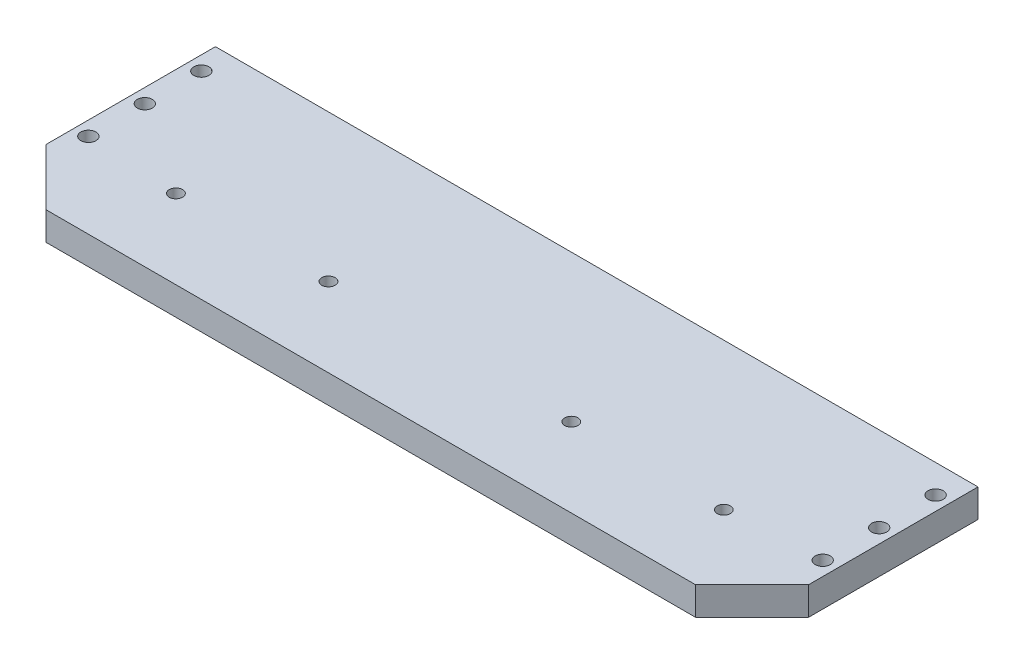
SolidWorks part; units mm, degrees
ref_plane "Front Plane" through (0, 0, 0) normal (0, 0, 1) x (1, 0, 0)
ref_plane "Top Plane" through (0, 0, 0) normal (0, 1, 0) x (1, 0, 0)
ref_plane "Right Plane" through (0, 0, 0) normal (1, 0, 0) x (0, 0, -1)
sketch "Sketch1" plane through (0, 0, 0) normal (0, 0, 1) x (1, 0, 0)
  line L0 (-223.8, 279.4) -> (-12.7, 279.4) construction
  line L1 (-32.5251, 279.4) -> (-203.9751, 279.4)
  line L2 (-32.5251, 279.4) -> (-32.5251, 273.05)
  line L3 (-32.5251, 273.05) -> (-203.9751, 273.05)
  line L4 (-203.9751, 279.4) -> (-203.9751, 273.05)
  line L5 (-12.474, 431.1636) -> (-12.474, 127.8876) construction
  dimension "D1" = 6.35
  dimension "D2" = 171.45
  dimension "D3" = 20.0511
extrude "Boss-Extrude1" add sketch "Sketch1" along normal blind 50.8
chamfer "Chamfer1" distance 12.7 angle 45 2 edges at (-203.9751, 276.225, 50.8) (-32.5251, 276.225, 50.8)
sketch "Sketch3" plane through (0, 279.4, 0) normal (0, 1, 0) x (1, 0, 0)
  circle A0 centre (-90.9451, -33.02) radius 1.5
  circle A1 centre (-56.6551, -33.02) radius 1.5
  circle A2 centre (-145.5551, -33.02) radius 1.5
  circle A3 centre (-179.8451, -33.02) radius 1.5
  dimension "D1" = 3
  dimension "D2" = 3
extrude "Cut-Extrude2" cut sketch "Sketch3" against normal through all
sketch "Sketch4" plane through (0, 279.4, 0) normal (0, 1, 0) x (1, 0, 0)
  line L0 (-203.9751, -38.1) -> (-203.9751, 0) construction
  line L1 (-32.5251, 0) -> (-203.9751, 0) construction
  line L2 (-197.6251, 0) -> (-197.6251, -44.45) construction
  line L3 (-203.9751, -38.1) -> (-191.2751, -50.8) construction
  line L4 (-203.9751, -19.05) -> (-197.6251, -19.05) construction
  line L5 (-200.8001, -19.05) -> (-200.8001, 0) construction
  line L6 (-118.2501, 0) -> (-118.2501, -50.8) construction
  line L7 (-45.2251, -50.8) -> (-191.2751, -50.8) construction
  circle A0 centre (-200.8001, -6.35) radius 1.7
  circle A1 centre (-200.8001, -19.05) radius 1.7
  circle A2 centre (-200.8001, -31.75) radius 1.7
  circle A3 centre (-35.7001, -31.75) radius 1.7
  circle A4 centre (-35.7001, -19.05) radius 1.7
  circle A5 centre (-35.7001, -6.35) radius 1.7
  dimension "D2" = 3.4
  dimension "D1" = 6.35
  dimension "D3" = 12.7
extrude "Cut-Extrude3" cut sketch "Sketch4" against normal through all
